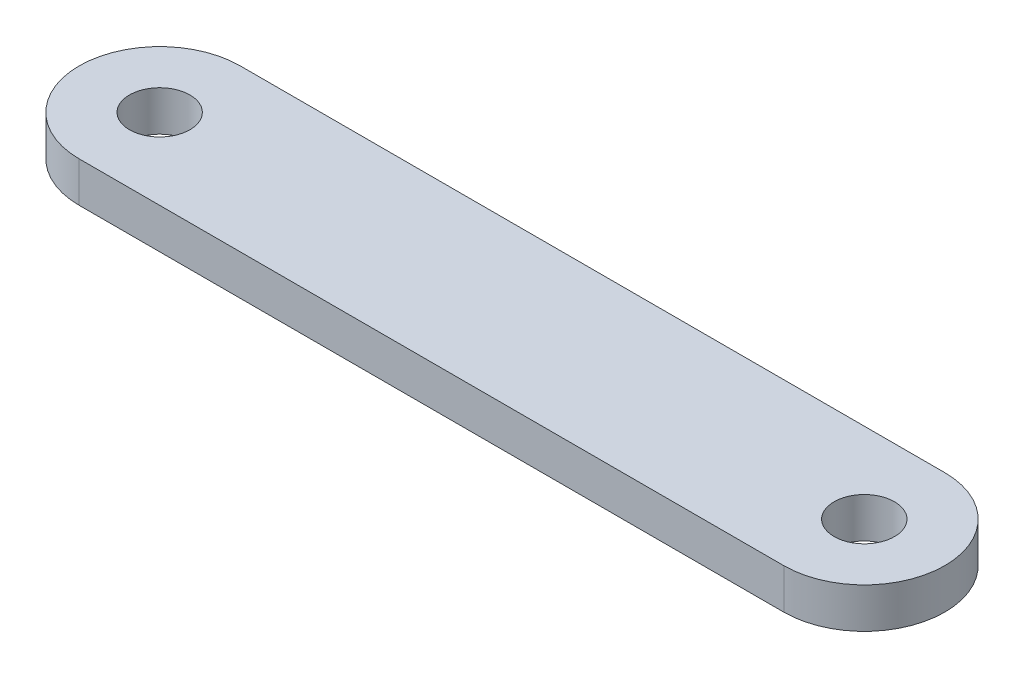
SolidWorks part; units mm, degrees
ref_plane "Front" through (0, 0, 0) normal (0, 0, 1) x (1, 0, 0)
ref_plane "Top" through (0, 0, 0) normal (0, 1, 0) x (1, 0, 0)
ref_plane "Right" through (0, 0, 0) normal (1, 0, 0) x (0, 0, -1)
sketch "草图1" plane through (0, 0, 0) normal (0, 1, 0) x (1, 0, 0)
  line L0 (0, 0) -> (35, 0) construction
  line L1 (0, 4) -> (35, 4)
  line L2 (0, -4) -> (35, -4)
  arc A0 (0, 4) -> (0, -4) centre (0, 0) ccw
  arc A1 (35, -4) -> (35, 4) centre (35, 0) ccw
  circle A2 centre (0, 0) radius 1.5
  circle A3 centre (35, 0) radius 1.5
  point P3 (17.5, 0)
  dimension "D1" = 4
  dimension "D3" = 3
  dimension "D4" = 3
  dimension "D2" = 35
extrude "凸台-拉伸1" add sketch "草图1" along normal blind 2
